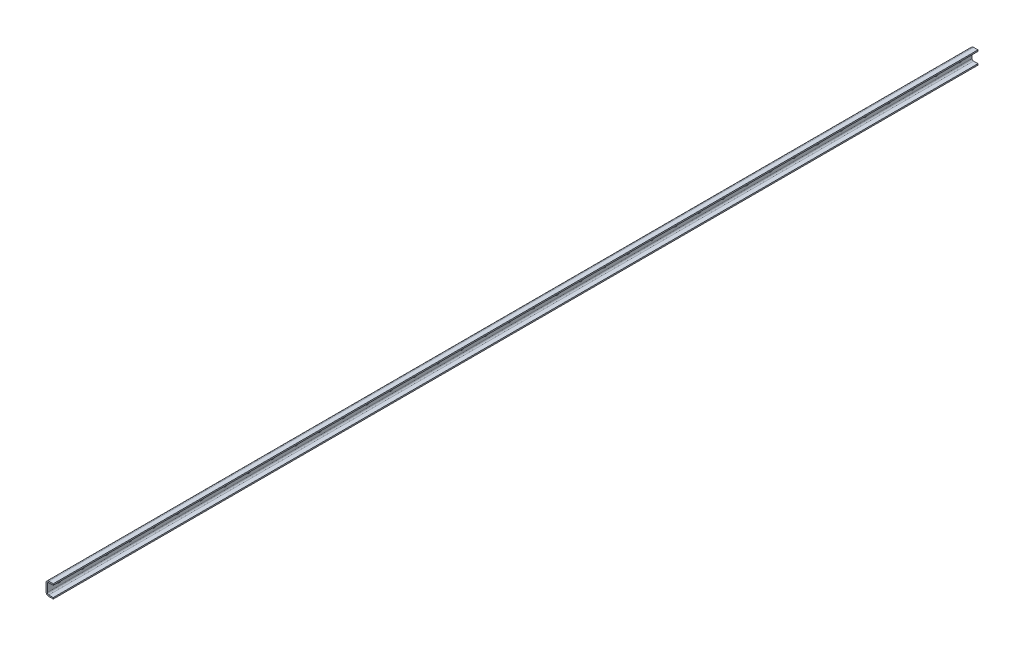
SolidWorks part; units mm, degrees
ref_plane "Front Plane" through (0, 0, 0) normal (0, 0, 1) x (1, 0, 0)
ref_plane "Top Plane" through (0, 0, 0) normal (0, 1, 0) x (1, 0, 0)
ref_plane "Right Plane" through (0, 0, 0) normal (1, 0, 0) x (0, 0, -1)
sketch "Sketch1" plane through (0, 0, 0) normal (0, 0, 1) x (1, 0, 0)
  line L0 (24.5, 17.9) -> (24.5, 22.4)
  line L1 (24.5, 22.4) -> (9.5, 22.4)
  line L2 (0, 12.9) -> (0, -12.9)
  line L3 (9.5, -22.4) -> (24.5, -22.4)
  line L4 (24.5, -22.4) -> (24.5, -17.9)
  line L5 (24.5, -17.9) -> (9.5, -17.9)
  line L6 (4.5, -12.9) -> (4.5, 12.9)
  line L7 (9.5, 17.9) -> (24.5, 17.9)
  arc A0 (9.5, 22.4) -> (0, 12.9) centre (9.5, 12.9) ccw
  arc A1 (0, -12.9) -> (9.5, -22.4) centre (9.5, -12.9) ccw
  arc A2 (9.5, -17.9) -> (4.5, -12.9) centre (9.5, -12.9) cw
  arc A3 (4.5, 12.9) -> (9.5, 17.9) centre (9.5, 12.9) cw
  dimension "D1" = 9.5
  dimension "D2" = 5
  dimension "D3" = 24.5
  dimension "D4" = 17.9
  dimension "D5" = 17.9
extrude "Extrude1" add sketch "Sketch1" against normal blind 3120
sketch "Sketch2" plane through (4.5, 0, 0) normal (1, 0, 0) x (0, 0, -1)
  line L0 (39, 0) -> (41, 0) construction
  line L1 (39, 4.5) -> (41, 4.5)
  line L2 (39, -4.5) -> (41, -4.5)
  arc A0 (39, 4.5) -> (39, -4.5) centre (39, 0) ccw
  arc A1 (41, 4.5) -> (41, -4.5) centre (41, 0) cw
  point P9 (40, 0)
  dimension "D1" = 2
  dimension "D2" = 9
  dimension "D3" = 40
extrude "Extrude2" cut sketch "Sketch2" against normal through all
pattern_linear "LPattern1" count 39 spacing 80 along (0, 0, -1) of "Extrude2"
